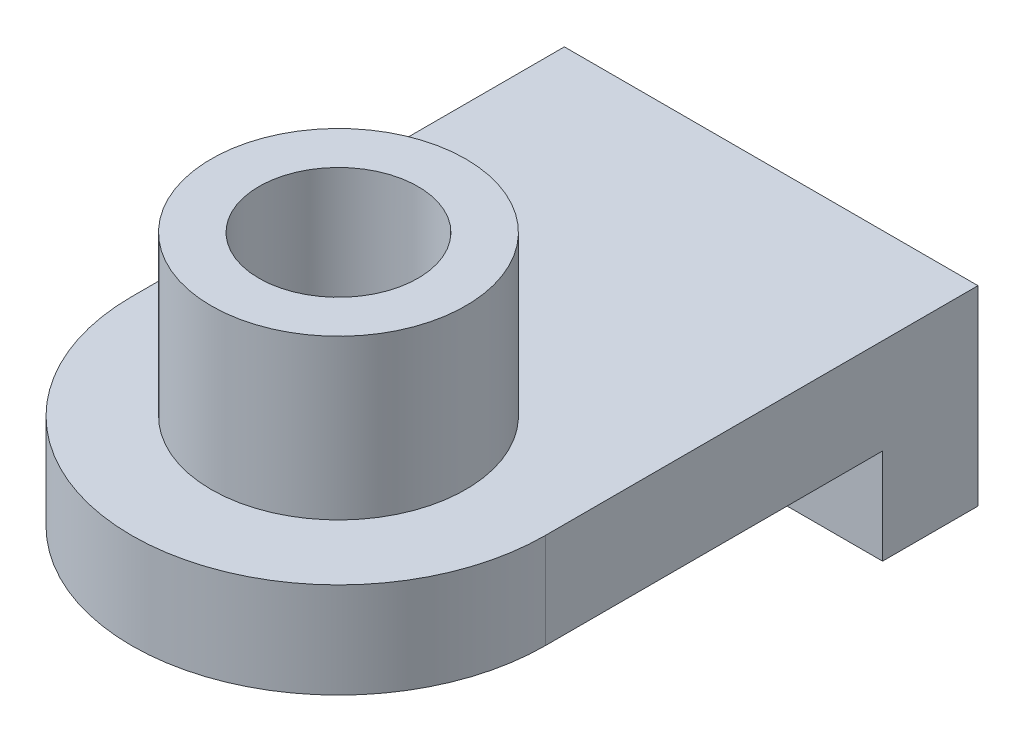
SolidWorks part; units mm, degrees
ref_plane "Front Plane" through (0, 0, 0) normal (0, 0, 1) x (1, 0, 0)
ref_plane "Top Plane" through (0, 0, 0) normal (0, 1, 0) x (1, 0, 0)
ref_plane "Right Plane" through (0, 0, 0) normal (1, 0, 0) x (0, 0, -1)
sketch "Sketch1" plane through (0, 0, 0) normal (0, 1, 0) x (1, 0, 0)
  line L0 (-32.5, 0) -> (-32.5, 68)
  line L1 (-32.5, 68) -> (32.5, 68)
  line L2 (32.5, 68) -> (32.5, 0)
  arc A0 (32.5, 0) -> (-32.5, 0) centre (0, 0) cw
  dimension "D1" = 65
  dimension "D2" = 68
extrude "Extrude1" add sketch "Sketch1" along normal blind 15
sketch "Sketch2" plane through (0, 0, 0) normal (0, -1, 0) x (1, 0, 0)
  line L0 (32.5, 0) -> (32.5, -68) construction
  line L1 (-32.5, -68) -> (32.5, -68)
  line L2 (-32.5, -68) -> (-32.5, -53)
  line L3 (-32.5, -53) -> (32.5, -53)
  line L4 (32.5, -68) -> (32.5, -53)
  dimension "D1" = 15
extrude "Extrude2" add sketch "Sketch2" along normal blind 15
sketch "Sketch3" plane through (0, 15, 0) normal (0, 1, 0) x (-1, 0, 0)
  circle A0 centre (0, 0) radius 20
  dimension "D1" = 40
extrude "Extrude3" add sketch "Sketch3" along normal blind 25
sketch "Sketch4" plane through (0, 40, 0) normal (0, 1, 0) x (-1, 0, 0)
  circle A0 centre (0, 0) radius 12.5
  dimension "D1" = 25
extrude "Cut-Extrude1" cut sketch "Sketch4" against normal through all
